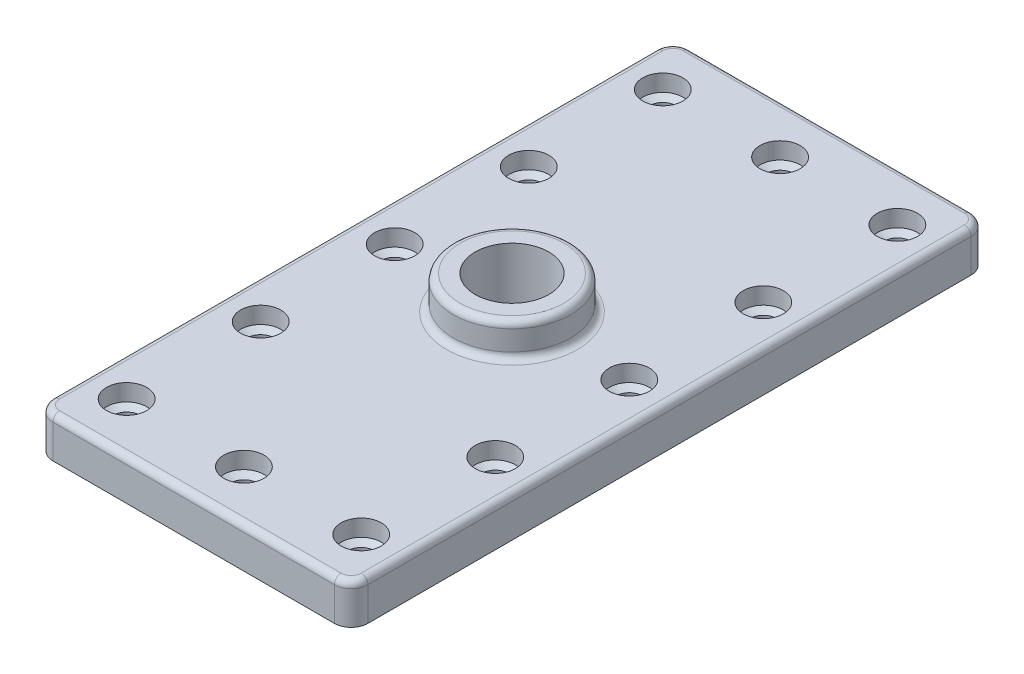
SolidWorks part; units mm, degrees
ref_plane "Front" through (0, 0, 0) normal (0, 0, 1) x (1, 0, 0)
ref_plane "Top" through (0, 0, 0) normal (0, 1, 0) x (1, 0, 0)
ref_plane "Right" through (0, 0, 0) normal (1, 0, 0) x (0, 0, -1)
sketch "Sketch1" plane through (0, 0, 0) normal (0, 1, 0) x (1, 0, 0)
  line L0 (-47, 95) -> (47, -95) construction
  line L1 (-47, -95) -> (47, -95)
  line L2 (-47, -95) -> (-47, 95)
  line L3 (-47, 95) -> (47, 95)
  line L4 (47, -95) -> (47, 95)
  dimension "D1" = 190
  dimension "D2" = 94
extrude "plate" add sketch "Sketch1" along normal blind 12
sketch "Sketch2" plane through (0, 12, 0) normal (0, 1, 0) x (-1, 0, 0)
  circle A0 centre (0, 0) radius 17.5
  dimension "D1" = 35
extrude "boss" add sketch "Sketch2" along normal blind 10
sketch "Sketch3" plane through (0, 22, 0) normal (0, 1, 0) x (-1, 0, 0)
  circle A0 centre (0, 0) radius 11
  dimension "D1" = 22
extrude "center hole" cut sketch "Sketch3" against normal through all
hole_wizard "pattern hole" positions "Sketch5" profile "Sketch4" legacy
sketch "Sketch5" plane through (0, 12, 0) normal (0, 1, 0) x (-1, 0, 0)
  line L0 (47, 95) -> (-47, 95) construction
  line L1 (47, -95) -> (47, 95) construction
  point P0 (35, 80)
  dimension "D1" = 15
  dimension "D2" = 12
sketch "Sketch4" plane through (-35, 12, 80) normal (1, 0, 0) x (0, 0, 1)
  line L0 (0, 0) -> (0, 12)
  line L1 (0, 12) -> (4, 12)
  line L2 (4, 12) -> (4, 6.2017)
  line L3 (4, 6.2017) -> (6, 5)
  line L4 (6, 5) -> (6, 0)
  line L5 (6, 0) -> (0, 0)
  line L6 (0, -6.13) -> (0, 109.2824) construction
  line L7 (-4, 6.2017) -> (-6, 5) construction
  line L8 (0, 12) -> (-4, 12) construction
  dimension "Diameter" = 8
  dimension "Depth" = 12
  dimension "C-Drill Diameter" = 12
  dimension "C-Drill Depth" = 5
  dimension "C-Drill Angle" = 118
fillet "R5" radius 5 4 edges at (-47, 6, -95) (47, 6, -95) (47, 6, 95) (-47, 6, 95)
fillet "R2" radius 2 10 edges at (0, 12, -17.5) (0, 22, 17.5) (47, 12, 0) (0, 12, 95) (-47, 12, 0) (0, 12, -95) (45.5355, 12, -93.5355) (-45.5355, 12, -93.5355) (-45.5355, 12, 93.5355) (45.5355, 12, 93.5355)
pattern_linear "LinearPattern" count 5 spacing 40 along (0, 0, -1) count 3 spacing 35 along (1, 0, 0) of "pattern hole"
sketch "Sketch Pattern" plane through (0, 12, 0) normal (0, 1, 0) x (-1, 0, 0)
  line L0 (0, 0) -> (0, -49.2733) construction
  point P0 (35, 40)
  point P1 (35, 0)
  point P2 (35, -40)
  point P3 (35, -80)
  point P4 (0, -80)
  point P5 (-35, -80)
  point P6 (-35, -40)
  point P7 (-35, 0)
  point P8 (-35, 40)
  point P9 (-35, 80)
  point P10 (0, 80)
  dimension "D1" = 40
  dimension "D2" = 80
  dimension "D3" = 120
  dimension "D4" = 160
  dimension "D5" = 70
pattern_sketch "Sketch-Pattern1"
other "TableDrivenPattern" parameters "D0"=35, "D1"=0, "D2"=35, "D3"=40, "D4"=35, "D5"=80, "D6"=35, "D7"=40, "D8"=35, "D9"=80, "D10"=0, "D11"=80, "D12"=0, "D13"=80, "D14"=35, "D15"=0, "D16"=35, "D17"=40, "D18"=35, "D19"=80, "D20"=35, "D21"=40
